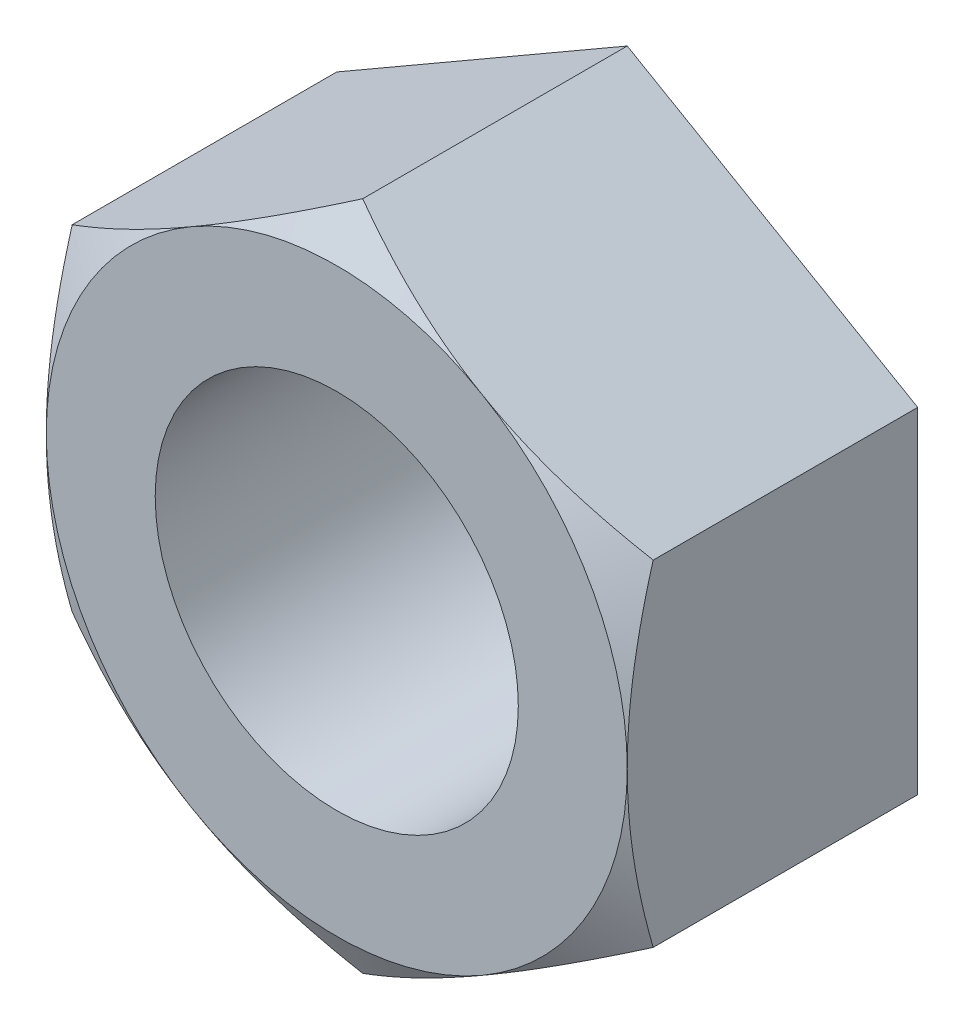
SolidWorks part; units mm, degrees
ref_plane "Front Plane" through (0, 0, 0) normal (0, 0, 1) x (1, 0, 0)
ref_plane "Top Plane" through (0, 0, 0) normal (0, 1, 0) x (1, 0, 0)
ref_plane "Right Plane" through (0, 0, 0) normal (1, 0, 0) x (0, 0, -1)
imported_body "Imported3"
sketch "Sketch1" plane through (0, 0, 3.6427) normal (0, 0, -1) x (-1, 0, 0)
  line L0 (4, 2.3094) -> (4, -2.3094)
  line L1 (4, -2.3094) -> (0, -4.6188)
  line L2 (0, -4.6188) -> (-4, -2.3094)
  line L3 (-4, -2.3094) -> (-4, 2.3094)
  line L4 (-4, 2.3094) -> (0, 4.6188)
  line L5 (0, 4.6188) -> (4, 2.3094)
extrude "Boss-Extrude1" add sketch "Sketch1" along normal blind 3.6427
hole_wizard "#10 Clearance Hole1" positions "Sketch3" profile "Sketch2" hole size "#10" standard "ANSI Inch"
sketch "Sketch3" plane through (0, 0, 0) normal (0, 0, -1) x (-1, 0, 0)
  point P0 (0, 0)
sketch "Sketch2" plane through (0, 0, 0) normal (1, 0, 0) x (0, 1, 0)
  line L0 (0, 0) -> (0, 4)
  line L1 (0, 4) -> (2.5, 4)
  line L2 (2.5, 4) -> (2.5, 0)
  line L5 (2.5, 0) -> (0, 0)
  line L11 (0, -6.35) -> (0, 107.95) construction
  dimension "Thru Hole Dia." = 5
  dimension "Thru Hole Depth" = 4
